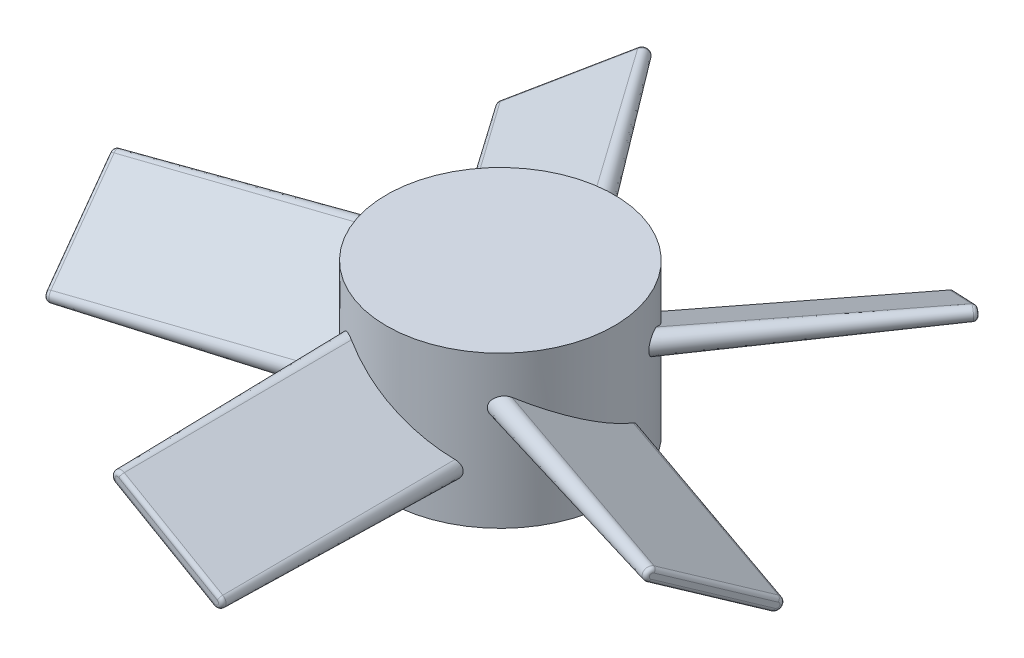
SolidWorks part; units mm, degrees
ref_plane "Front Plane" through (0, 0, 0) normal (0, 0, 1) x (1, 0, 0)
ref_plane "Top Plane" through (0, 0, 0) normal (0, 1, 0) x (1, 0, 0)
ref_plane "Right Plane" through (0, 0, 0) normal (1, 0, 0) x (0, 0, -1)
sketch "Sketch1" plane through (0, 0, 0) normal (0, 1, 0) x (1, 0, 0)
  circle A0 centre (0, 0) radius 38.1
  dimension "D1" = 76.2
extrude "Boss-Extrude1" add sketch "Sketch1" along normal blind 50.8
sketch "Sketch2" plane through (0, 0, 0) normal (0, 0, 1) x (1, 0, 0)
  line L0 (-16.4978, 34.925) -> (16.4978, 15.875) construction
  line L1 (-14.4658, 38.4445) -> (18.5298, 19.3945)
  line L2 (-18.5298, 31.4055) -> (14.4658, 12.3555)
  line L3 (0, 25.4) -> (0, 0) construction
  arc A0 (-14.4658, 38.4445) -> (-18.5298, 31.4055) centre (-16.4978, 34.925) ccw
  arc A1 (14.4658, 12.3555) -> (18.5298, 19.3945) centre (16.4978, 15.875) ccw
  point P2 (0, 25.4)
  point P10 (-16.0879, 36.7295)
  dimension "D1" = 60
  dimension "D2" = 25.4
  dimension "D3" = 8.128
  dimension "D4" = 38.1
extrude "Boss-Extrude2" add sketch "Sketch2" along normal blind 111.76 draft 1
fillet "Fillet1" radius 1.27 4 edges at (18.3279, 14.8184, 111.76) (-1.0566, 23.5699, 111.76) (-18.3279, 35.9816, 111.76) (1.0566, 27.2301, 111.76)
pattern_circular "CirPattern1" count 5 over 360 about axis through (0, 0, 0) along (0, 1, 0) of "Boss-Extrude2", "Fillet1"
